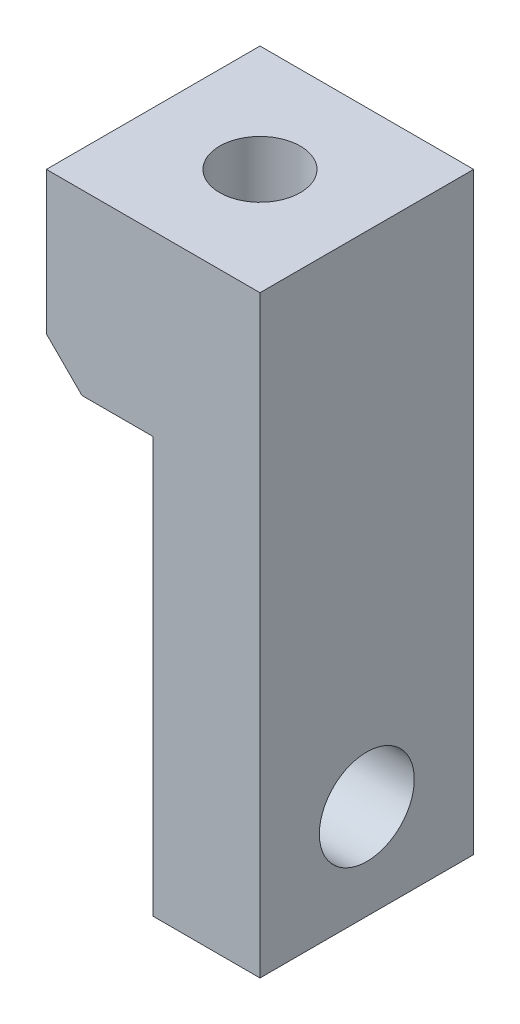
SolidWorks part; units mm, degrees
ref_plane "Face" through (0, 0, 0) normal (0, 0, 1) x (1, 0, 0)
ref_plane "Dessus" through (0, 0, 0) normal (0, 1, 0) x (1, 0, 0)
ref_plane "Droite" through (0, 0, 0) normal (1, 0, 0) x (0, 0, -1)
sketch "Esquisse1" plane through (0, 0, 0) normal (0, 0, 1) x (1, 0, 0)
  line L0 (0, 0) -> (0, 35)
  line L1 (0, 35) -> (-6, 35)
  line L2 (-9, 38) -> (-9, 50)
  line L3 (-9, 50) -> (9, 50)
  line L4 (9, 50) -> (9, 0)
  line L5 (9, 0) -> (0, 0)
  line L6 (-6, 35) -> (-9, 38)
  point P4 (-9, 35)
  dimension "D1" = 9
  dimension "D2" = 18
  dimension "D3" = 50
  dimension "D4" = 15
  dimension "D7" = 3
extrude "Extrusion1" add sketch "Esquisse1" along normal blind 18
hole_wizard "Trou taraudé M81" positions "Esquisse3" profile "Esquisse2" tap size "M8" standard "ISO"
sketch "Esquisse3" plane through (0, 50, 0) normal (0, 1, 0) x (-1, 0, 0)
  line L0 (-9, 18) -> (-9, 0) construction
  line L1 (-9, 0) -> (9, 0) construction
  point P0 (0, 9)
  dimension "D1" = 9
  dimension "D2" = 9
sketch "Esquisse2" plane through (0, 50, 9) normal (1, 0, 0) x (0, 0, 1)
  line L0 (0, 0) -> (0, 28.0429)
  line L1 (0, 28.0429) -> (3.4, 26)
  line L2 (3.4, 26) -> (3.4, 0)
  line L5 (3.4, 0) -> (0, 0)
  line L10 (0, 28.0429) -> (-3.4, 26) construction
  line L11 (0, -6.35) -> (0, 107.95) construction
  dimension "Diamètre du trou pour taraudage" = 6.8
  dimension "Profondeur du trou pour taraudage" = 26
  dimension "Angle de pointe" = 118
sketch "Esquisse4" plane through (0, 0, 0) normal (-1, 0, 0) x (0, 0, 1)
  line L0 (18, 35) -> (18, 0) construction
  line L1 (18, 0) -> (0, 0) construction
  circle A0 centre (9, 8) radius 4
  dimension "D1" = 8
  dimension "D2" = 9
  dimension "D3" = 8
extrude "Enlèv. mat.-Extru.1" cut sketch "Esquisse4" against normal through all
